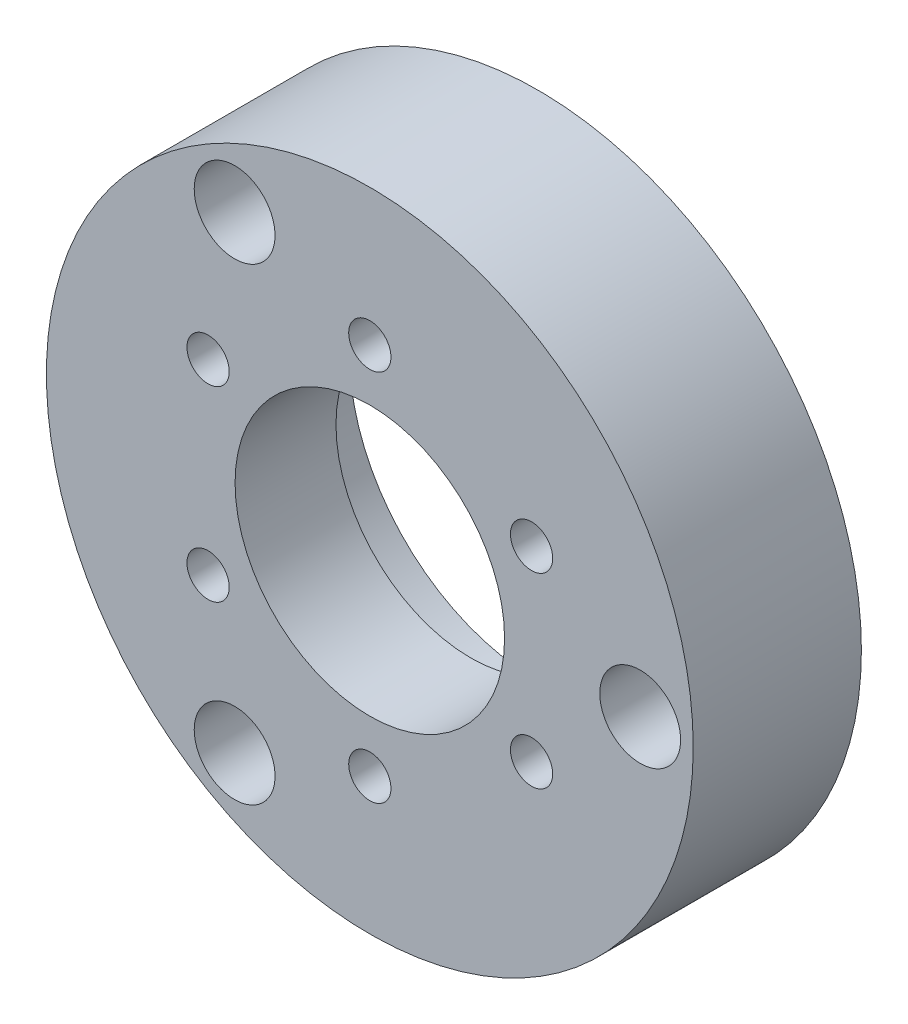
SolidWorks part; units mm, degrees
ref_plane "Front Plane" through (0, 0, 0) normal (0, 0, 1) x (1, 0, 0)
ref_plane "Top Plane" through (0, 0, 0) normal (0, 1, 0) x (1, 0, 0)
ref_plane "Right Plane" through (0, 0, 0) normal (1, 0, 0) x (0, 0, -1)
sketch "Sketch1" plane through (0, 0, 0) normal (1, 0, 0) x (0, 0, -1)
  line L0 (0, 22.1996) -> (-7.9248, 22.1996)
  line L1 (-7.9248, 22.1996) -> (-7.9248, 15.875)
  line L2 (-7.9248, 15.875) -> (-19.812, 15.875)
  line L3 (-19.812, 15.875) -> (-19.812, 38.1)
  line L4 (-19.812, 38.1) -> (0, 38.1)
  line L5 (0, 38.1) -> (0, 22.1996)
  line L6 (0, 0) -> (36.9025, 0) construction
  dimension "D1" = 31.75
  dimension "D2" = 44.3992
  dimension "D3" = 7.9248
  dimension "D4" = 19.812
  dimension "D5" = 76.2
  dimension "D6" = 11.8872
revolve "Revolve1" add sketch "Sketch1" angle 360 about L6
sketch "Sketch2" plane through (0, 0, 0) normal (0, 0, 1) x (1, 0, 0)
  circle A0 centre (0, 22) radius 2.4892
  dimension "D1" = 4.9784
  dimension "D2" = 22
extrude "Cut-Extrude1" cut sketch "Sketch2" along normal blind 25.4 from offset 6.35
pattern_circular "CirPattern1" count 6 over 360 about axis through (0, 0, 0) along (0, 0, 1) of "Cut-Extrude1"
sketch "Sketch3" plane through (0, 0, 0) normal (0, 0, 1) x (1, 0, 0)
  line L0 (0, 0) -> (0, 51.4659) construction
  line L1 (0, 0) -> (-15.9258, 27.5843) construction
  line L2 (0, 0) -> (31.8516, 0) construction
  line L3 (0, 0) -> (-15.9258, -27.5843) construction
  circle A0 centre (-15.9258, 27.5843) radius 3.175
  circle A1 centre (31.8516, 0) radius 3.175
  circle A2 centre (-15.9258, -27.5843) radius 3.175
  circle A3 centre (31.8516, 0) radius 4.7625
  circle A4 centre (-15.9258, 27.5843) radius 4.7625
  circle A5 centre (-15.9258, -27.5843) radius 4.7625
  dimension "D5" = 6.35
  dimension "D6" = 9.525
  dimension "D1" = 30
  dimension "D2" = 120
  dimension "D3" = 120
  dimension "D4" = 31.8516
sketch "Sketch4" plane through (0, 0, 0) normal (0, 0, 1) x (1, 0, 0)
  circle A0 centre (-15.9258, -27.5843) radius 3.175 construction
  circle A1 centre (31.8516, 0) radius 3.175 construction
  circle A2 centre (-15.9258, 27.5843) radius 3.175 construction
  circle A3 centre (-15.9258, -27.5843) radius 3.175
  circle A4 centre (31.8516, 0) radius 3.175
  circle A5 centre (-15.9258, 27.5843) radius 3.175
extrude "Cut-Extrude2" cut sketch "Sketch4" along normal blind 50.8
sketch "Sketch5" plane through (0, 0, 0) normal (0, 0, 1) x (1, 0, 0)
  circle A0 centre (-15.9258, 27.5843) radius 4.7625 construction
  circle A1 centre (-15.9258, -27.5843) radius 4.7625 construction
  circle A2 centre (31.8516, 0) radius 4.7625 construction
  circle A3 centre (-15.9258, 27.5843) radius 4.7625
  circle A4 centre (-15.9258, -27.5843) radius 4.7625
  circle A5 centre (31.8516, 0) radius 4.7625
extrude "Cut-Extrude3" cut sketch "Sketch5" along normal blind 50.8 from offset 6.35
